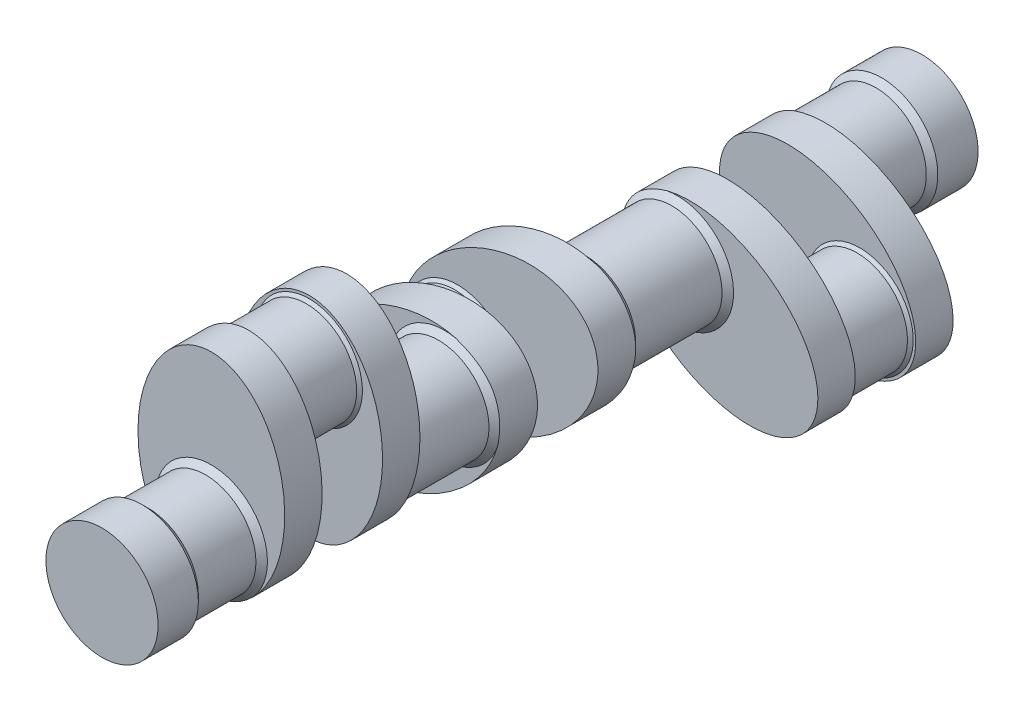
SolidWorks part; units mm, degrees
ref_plane "Front Plane" through (0, 0, 0) normal (0, 0, 1) x (1, 0, 0)
ref_plane "Top Plane" through (0, 0, 0) normal (0, 1, 0) x (1, 0, 0)
ref_plane "Right Plane" through (0, 0, 0) normal (1, 0, 0) x (0, 0, -1)
sketch "Sketch1" plane through (0, 0, 0) normal (1, 0, 0) x (0, 0, -1)
  line L0 (-1747.9139, 0) -> (85647.7802, 0) construction
  line L1 (0, 0) -> (0, 19.5)
  line L2 (0, 19.5) -> (14, 19.5)
  line L3 (14, 19.5) -> (14, 17.5)
  line L4 (14, 17.5) -> (38, 17.5)
  line L5 (38, 17.5) -> (38, 0)
  line L6 (38, 0) -> (0, 0)
  dimension "D1" = 39
  dimension "D2" = 35
  dimension "D3" = 24
  dimension "D4" = 14
revolve "Revolve1" add sketch "Sketch1" angle 360 about L0
sketch "Sketch2" plane through (0, 0, -38) normal (0, 0, -1) x (-1, 0, 0)
  line L0 (0, 0) -> (0, 34) construction
  circle A0 centre (0, 17) radius 36.5 construction
  circle A1 centre (0, 17) radius 25.5 construction
  ellipse E0 centre (0, 17) end of major axis (0, 53.5) minor radius 25.5
  point P6 (0, 0)
  point P12 (0, 0)
  dimension "D2" = 73
  dimension "D3" = 51
  dimension "D1" = 34
extrude "Boss-Extrude1" add sketch "Sketch2" along normal blind 13
sketch "Sketch3" plane through (0, 0, -51) normal (0, 0, -1) x (-1, 0, 0)
  line L0 (0, 0) -> (0, 34) construction
  circle A0 centre (0, 34) radius 17.5
  dimension "D2" = 35
  dimension "D1" = 34
extrude "Boss-Extrude2" add sketch "Sketch3" along normal blind 21
sketch "Sketch5" plane through (0, 0, -72) normal (0, 0, -1) x (-1, 0, 0)
  line L0 (0, 34) -> (0, 0) construction
  circle A0 centre (0, 17) radius 25.5 construction
  circle A1 centre (0, 17) radius 36.5 construction
  ellipse E0 centre (0, 17) end of major axis (0, -19.5) minor radius 25.5
  dimension "D1" = 73
  dimension "D2" = 51
extrude "Boss-Extrude4" add sketch "Sketch5" along normal blind 13
sketch "Sketch6" plane through (0, 0, -85) normal (0, 0, -1) x (-1, 0, 0)
  circle A0 centre (0, 0) radius 17.5
  dimension "D1" = 35
extrude "Boss-Extrude5" add sketch "Sketch6" along normal blind 34
sketch "Sketch7" plane through (0, 0, -119) normal (0, 0, -1) x (-1, 0, 0)
  line L0 (0, 0) -> (0, 53.5) construction
  line L1 (0, 0) -> (29.4449, -17) construction
  line L2 (0, 0) -> (-16.8875, 9.75) construction
  circle A0 centre (14.7224, -8.5) radius 25.5 construction
  circle A1 centre (14.7224, -8.5) radius 36.5 construction
  ellipse E0 centre (0, 17) end of major axis (0, -19.5) minor radius 25.5 construction
  ellipse E1 centre (14.7224, -8.5) end of major axis (-16.8875, 9.75) minor radius 25.5
  point P14 (-46.3324, -26.75)
  point P20 (-46.3324, -26.75)
  point P21 (-0.5384, -33.0675)
  dimension "D3" = 73
  dimension "D4" = 51
  dimension "D1" = 34
  dimension "D2" = 240
extrude "Boss-Extrude6" add sketch "Sketch7" along normal blind 13
sketch "Sketch8" plane through (0, 0, -132) normal (0, 0, -1) x (-1, 0, 0)
  line L0 (0, 53.5) -> (0, 0) construction
  line L1 (0, 0) -> (29.4449, -17) construction
  circle A0 centre (29.4449, -17) radius 17.5
  ellipse E0 centre (0, 17) end of major axis (0, -19.5) minor radius 25.5 construction
  dimension "D3" = 35
  dimension "D1" = 34
  dimension "D2" = 240
extrude "Boss-Extrude7" add sketch "Sketch8" along normal blind 21
sketch "Sketch9" plane through (0, 0, -153) normal (0, 0, -1) x (-1, 0, 0)
  line L0 (0, 0) -> (0, 53.5) construction
  line L1 (0, 0) -> (14.7224, -8.5) construction
  line L2 (0, 0) -> (-16.8875, 9.75) construction
  circle A0 centre (14.7224, -8.5) radius 36.5 construction
  circle A1 centre (14.7224, -8.5) radius 25.5 construction
  ellipse E0 centre (0, 17) end of major axis (0, -19.5) minor radius 25.5 construction
  ellipse E1 centre (14.7224, -8.5) end of major axis (-16.8875, 9.75) minor radius 25.5
  point P12 (0, 0)
  dimension "D3" = 73
  dimension "D4" = 51
  dimension "D1" = 17
  dimension "D2" = 240
extrude "Boss-Extrude8" add sketch "Sketch9" along normal blind 13 contours E1
sketch "Sketch10" plane through (0, 0, -166) normal (0, 0, -1) x (-1, 0, 0)
  circle A0 centre (0, 0) radius 17.5
  dimension "D1" = 35
extrude "Boss-Extrude9" add sketch "Sketch10" along normal blind 34
sketch "Sketch11" plane through (0, 0, -200) normal (0, 0, -1) x (-1, 0, 0)
  line L0 (0, 53.5) -> (0, 0) construction
  line L1 (0, 0) -> (-29.4449, -17) construction
  line L2 (0, 0) -> (16.8875, 9.75) construction
  circle A0 centre (-14.7224, -8.5) radius 25.5 construction
  circle A1 centre (-14.7224, -8.5) radius 36.5 construction
  ellipse E0 centre (0, 17) end of major axis (0, -19.5) minor radius 25.5 construction
  ellipse E1 centre (-14.7224, -8.5) end of major axis (16.8875, 9.75) minor radius 25.5
  point P13 (0, 0)
  dimension "D3" = 73
  dimension "D4" = 51
  dimension "D1" = 240
  dimension "D2" = 34
extrude "Boss-Extrude10" add sketch "Sketch11" along normal blind 13
sketch "Sketch12" plane through (0, 0, -213) normal (0, 0, -1) x (-1, 0, 0)
  line L0 (0, 53.5) -> (0, 0) construction
  line L1 (0, 0) -> (-29.4449, -17) construction
  circle A0 centre (-29.4449, -17) radius 17.5
  ellipse E0 centre (0, 17) end of major axis (0, -19.5) minor radius 25.5 construction
  dimension "D3" = 35
  dimension "D1" = 120
  dimension "D2" = 34
extrude "Boss-Extrude11" add sketch "Sketch12" along normal blind 21
sketch "Sketch13" plane through (0, 0, -234) normal (0, 0, -1) x (-1, 0, 0)
  line L0 (0, 53.5) -> (0, 0) construction
  line L1 (0, 0) -> (-29.4449, -17) construction
  line L2 (0, 0) -> (16.8875, 9.75) construction
  circle A0 centre (-14.7224, -8.5) radius 36.5 construction
  circle A1 centre (-14.7224, -8.5) radius 25.5 construction
  ellipse E0 centre (0, 17) end of major axis (0, -19.5) minor radius 25.5 construction
  ellipse E1 centre (-14.7224, -8.5) end of major axis (16.8875, 9.75) minor radius 25.5
  point P13 (0, 0)
  point P20 (0, 0)
  dimension "D3" = 73
  dimension "D4" = 51
  dimension "D1" = 120
  dimension "D2" = 34
extrude "Boss-Extrude12" add sketch "Sketch13" along normal blind 13
sketch "Sketch14" plane through (0, 0, -247) normal (0, 0, -1) x (-1, 0, 0)
  circle A0 centre (0, 0) radius 17.5
  dimension "D1" = 35
extrude "Boss-Extrude13" add sketch "Sketch14" along normal blind 24
sketch "Sketch15" plane through (0, 0, -271) normal (0, 0, -1) x (-1, 0, 0)
  circle A0 centre (0, 0) radius 19.5
  dimension "D1" = 39
extrude "Boss-Extrude14" add sketch "Sketch15" along normal blind 14
chamfer "Chamfer2" distance 1 angle 45 6 edges at (11.9449, -17, -213) (11.9449, -17, -234) (-46.9449, -17, -132) (-46.9449, -17, -153) (-17.5, 34, -51) (-17.5, 34, -72)
chamfer "Chamfer3" distance 2 angle 45 8 edges at (-17.5, 0, -247) (-17.5, 0, -271) (-17.5, 0, -166) (-17.5, 0, -200) (-17.5, 0, -85) (-17.5, 0, -119) (17.5, 0, -38) (17.5, 0, -14)
